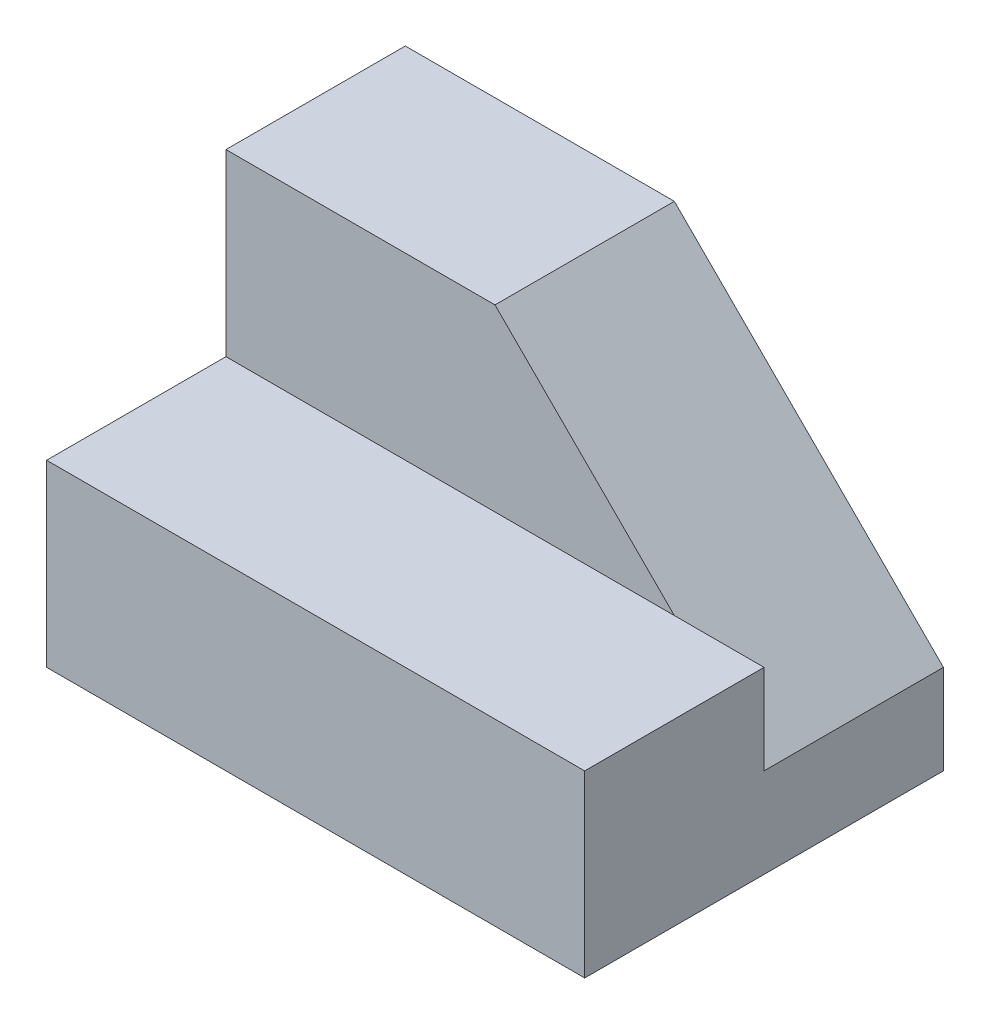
SolidWorks part; units mm, degrees
ref_plane "Front Plane" through (0, 0, 0) normal (0, 0, 1) x (1, 0, 0)
ref_plane "Top Plane" through (0, 0, 0) normal (0, 1, 0) x (1, 0, 0)
ref_plane "Right Plane" through (0, 0, 0) normal (1, 0, 0) x (0, 0, -1)
sketch "Sketch1" plane through (0, 0, 0) normal (0, 1, 0) x (1, 0, 0)
  line L0 (-30, -20) -> (30, 20) construction
  line L1 (-30, -20) -> (30, -20)
  line L2 (-30, -20) -> (-30, 20)
  line L3 (-30, 20) -> (30, 20)
  line L4 (30, -20) -> (30, 20)
  dimension "D1" = 60
  dimension "D2" = 40
extrude "Extrude1" add sketch "Sketch1" along normal blind 40
sketch "Sketch2" plane through (0, 0, 20) normal (0, 0, 1) x (1, 0, 0)
  line L0 (-30, 40) -> (-30, 0) construction
  line L1 (-30, 20) -> (30, 20)
  line L2 (-30, 20) -> (-30, 40)
  line L3 (-30, 40) -> (30, 40)
  line L4 (30, 20) -> (30, 40)
extrude "Extrude2" cut sketch "Sketch2" against normal blind 20
sketch "Sketch3" plane through (0, 0, -20) normal (0, 0, -1) x (-1, 0, 0)
  line L0 (0, 40) -> (-30, 10)
  line L1 (-30, 40) -> (30, 40) construction
  line L2 (-30, 40) -> (-30, 0) construction
  line L3 (-30, 10) -> (-30, 40)
  line L4 (-30, 40) -> (0, 40)
  line L5 (-30, 0) -> (30, 0) construction
  dimension "D1" = 10
extrude "Extrude3" cut sketch "Sketch3" against normal blind 20
